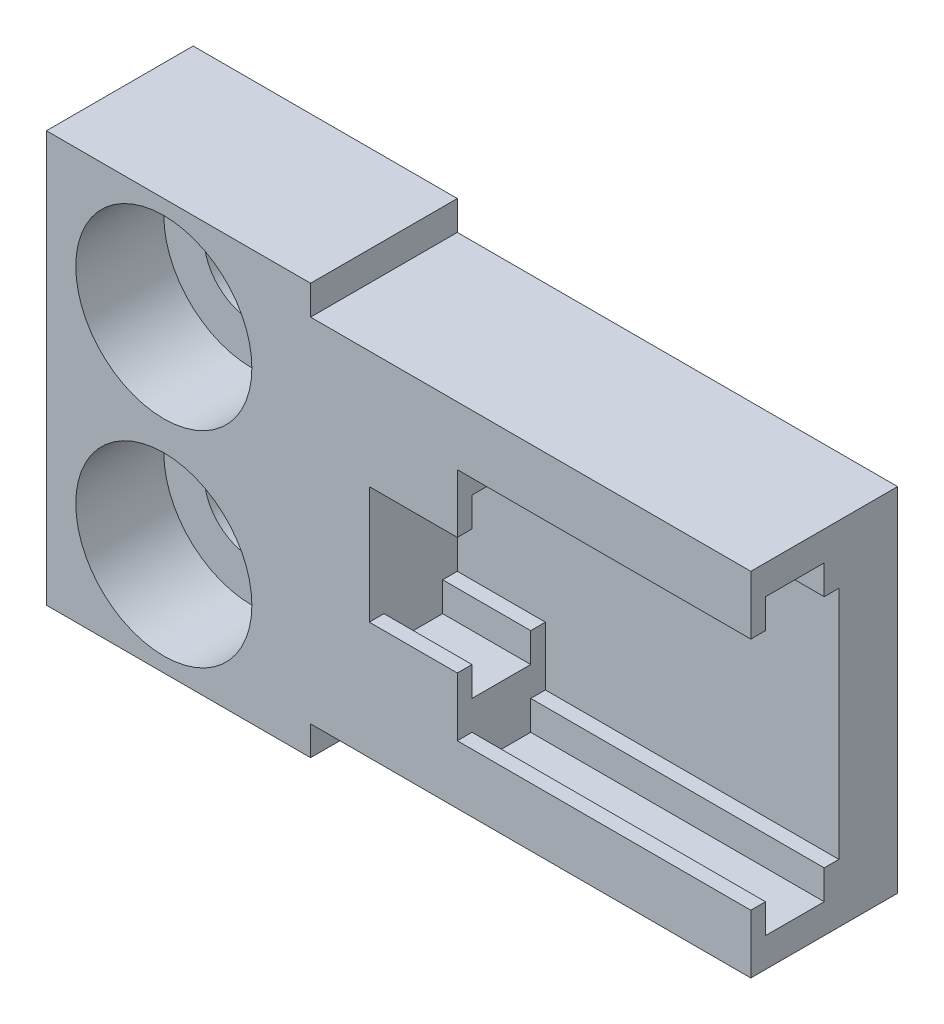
SolidWorks part; units mm, degrees
ref_plane "Front Plane" through (0, 0, 0) normal (0, 0, 1) x (1, 0, 0)
ref_plane "Top Plane" through (0, 0, 0) normal (0, 1, 0) x (1, 0, 0)
ref_plane "Right Plane" through (0, 0, 0) normal (1, 0, 0) x (0, 0, -1)
sketch "Croquis1" plane through (0, 0, 0) normal (0, 0, 1) x (1, 0, 0)
  line L1 (-7.5, -6) -> (7.5, -6)
  line L2 (-7.5, -6) -> (-7.5, 6)
  line L3 (-7.5, 6) -> (7.5, 6)
  line L4 (7.5, -6) -> (7.5, 6)
  line L5 (-7.5, -6) -> (7.5, 6) construction
  line L6 (-7.5, 6) -> (7.5, -6) construction
  point P0 (0, 0)
  dimension "D1" = 15
  dimension "D2" = 12
extrude "Saliente-Extruir1" add sketch "Croquis1" along normal blind 5
sketch "Croquis14" plane through (0, 0, 0) normal (0, 0, -1) x (-1, 0, 0)
  line L6 (7.5, -6) -> (7.5, -7)
  line L7 (0, 0) -> (24.6155, 0) construction
  line L11 (7.5, -7) -> (16.5, -7)
  line L12 (16.5, -7) -> (16.5, 7)
  line L13 (16.5, 7) -> (7.5, 7)
  line L14 (7.5, 7) -> (7.5, 6)
  line L15 (7.5, 6) -> (7.5, -6)
  dimension "D1" = 1
  dimension "D2" = 1
  dimension "D3" = 9
extrude "Saliente-Extruir2" add sketch "Croquis14" against normal blind 5
sketch "Croquis25" plane through (0, 0, 5) normal (0, 0, 1) x (1, 0, 0)
  circle A0 centre (-12.5002, -3.5) radius 3
  circle A1 centre (-12.5002, 3.5) radius 3
  dimension "D1" = 6
  dimension "D2" = 6
  dimension "D3" = 3.5
  dimension "D4" = 3.5
extrude "Cortar-Extruir21" cut sketch "Croquis25" against normal blind 3
sketch "Croquis26" plane through (0, 0, 2) normal (0, 0, 1) x (1, 0, 0)
  line L0 (-12.5002, 3.5) -> (-12.5002, -7.7705) construction
  line L1 (-16.5, 7) -> (-7.5, 7) construction
  line L2 (-16.5, -7) -> (-16.5, 7) construction
  circle A0 centre (-12.5002, -3.5) radius 1.625
  circle A1 centre (-12.5002, 3.5) radius 1.625
  point P11 (0, 0)
  point P12 (0, 0)
  point P14 (0, 0)
  point P15 (0, 0)
  point P16 (0, 0)
  dimension "D1" = 3.25
  dimension "D2" = 3.25
  dimension "D3" = 7
  dimension "D4" = 3.5
  dimension "D5" = 3.9998
  dimension "D6" = 3.5
  dimension "D7" = 3.5
extrude "Cortar-Extruir22" cut sketch "Croquis26" against normal blind 4
sketch "Croquis32" plane through (0, 0, 5) normal (0, 0, 1) x (1, 0, 0)
  line L10 (7.5, -6) -> (7.5, 6) construction
  line L11 (7.5, 4) -> (-2.5, 4)
  line L12 (7.5, 4) -> (7.5, -4)
  line L13 (7.5, -4) -> (-2.5, -4)
  line L14 (-2.5, 4) -> (-2.5, 2)
  line L15 (-2.5, -2) -> (-2.5, -4)
  line L16 (-2.5, 2) -> (-5.5, 2)
  line L18 (-2.5, -2) -> (-5.5, -2)
  line L19 (-5.5, 2) -> (-5.5, -2)
  dimension "D1" = 10
  dimension "D2" = 8
  dimension "D3" = 4
  dimension "D4" = 4
  dimension "D5" = 2
  dimension "D6" = 3
extrude "Cortar-Extruir25" cut sketch "Croquis32" against normal blind 3
sketch "Croquis33" plane through (7.5, 0, 0) normal (1, 0, 0) x (0, 0, -1)
  line L0 (-2, 4) -> (-5, 4) construction
  line L1 (-4.5, 4) -> (-2.5, 4)
  line L2 (-4.5, 4) -> (-4.5, 5)
  line L3 (-4.5, 5) -> (-2.5, 5)
  line L4 (-2.5, 4) -> (-2.5, 5)
  line L5 (-5, 4) -> (-5, 6) construction
  line L6 (-2, -4) -> (-2, 4) construction
  line L7 (0, 0) -> (-9.9044, 0) construction
  line L8 (-2.5, -4) -> (-2.5, -5)
  line L9 (-4.5, -5) -> (-2.5, -5)
  line L10 (-4.5, -4) -> (-4.5, -5)
  line L11 (-4.5, -4) -> (-2.5, -4)
  dimension "D1" = 0.5
  dimension "D2" = 0.5
  dimension "D3" = 2
  dimension "D4" = 1
extrude "Cortar-Extruir26" cut sketch "Croquis33" against normal blind 10
sketch "Croquis34" plane through (-2.5, 0, 0) normal (1, 0, 0) x (0, 0, -1)
  line L0 (-2, 2) -> (-5, 2) construction
  line L1 (-4.5, 2) -> (-2.5, 2)
  line L2 (-4.5, 2) -> (-4.5, 3)
  line L3 (-4.5, 3) -> (-2.5, 3)
  line L4 (-2.5, 2) -> (-2.5, 3)
  line L5 (-5, 4) -> (-5, 2) construction
  line L6 (-2, 4) -> (-2, 2) construction
  line L7 (-2, 2) -> (-5, 2) construction
  line L8 (0, 0) -> (-9.5194, 0) construction
  line L9 (-2.5, -2) -> (-2.5, -3)
  line L10 (-4.5, -3) -> (-2.5, -3)
  line L11 (-4.5, -2) -> (-4.5, -3)
  line L12 (-4.5, -2) -> (-2.5, -2)
  dimension "D1" = 0.5
  dimension "D2" = 0.5
  dimension "D3" = 2
  dimension "D4" = 1
extrude "Cortar-Extruir27" cut sketch "Croquis34" against normal blind 3
